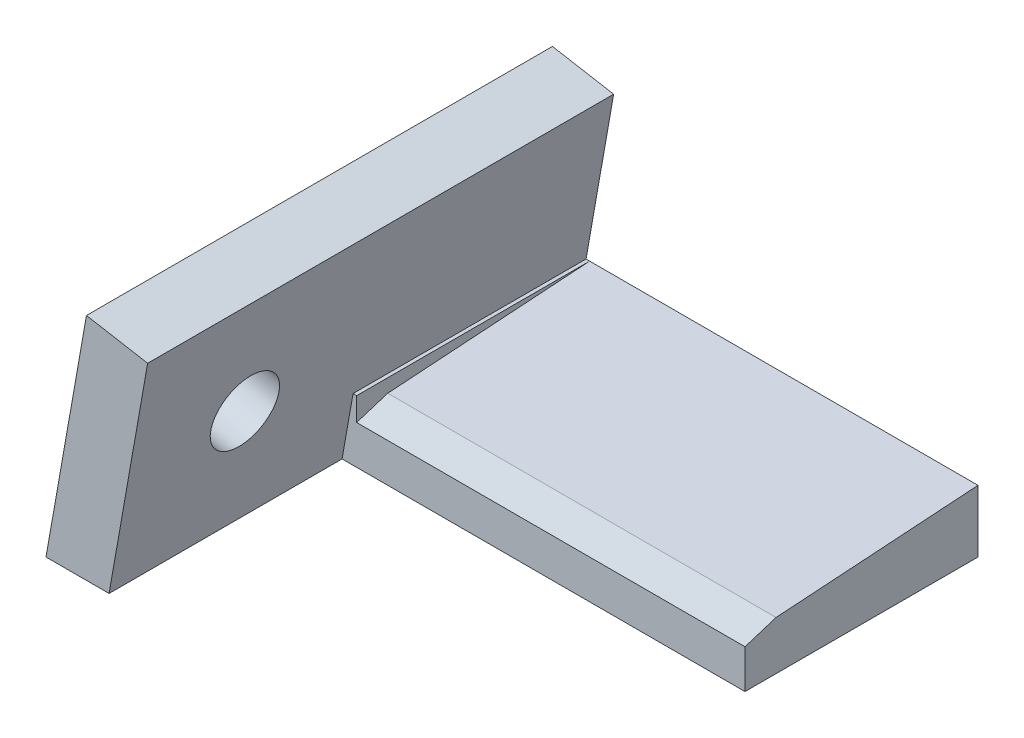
SolidWorks part; units mm, degrees
ref_plane "Спереди" through (0, 0, 0) normal (0, 0, 1) x (1, 0, 0)
ref_plane "Сверху" through (0, 0, 0) normal (0, 1, 0) x (1, 0, 0)
ref_plane "Справа" through (0, 0, 0) normal (1, 0, 0) x (0, 0, -1)
sketch "Эскиз1" plane through (0, 0, 0) normal (0, 0, 1) x (1, 0, 0)
  line L0 (0, 68.933) -> (0, -104.0312) construction
  line L1 (0, -104.0312) -> (0, 0) construction
  line L2 (0, 0) -> (103.0484, 0) construction
  line L3 (103.0484, 0) -> (-126.0729, 0) construction
  line L4 (0, -4) -> (30, -4)
  line L5 (30, -4) -> (30, 0)
  line L6 (30, 0) -> (4.767, 0)
  line L7 (4.767, 0) -> (6.544, 10.0775)
  line L8 (6.544, 10.0775) -> (2.6047, 10.7721)
  line L9 (2.6047, 10.7721) -> (0, -4)
  dimension "D1" = 80
  dimension "D2" = 4
  dimension "D3" = 4
  dimension "D4" = 15
  dimension "D5" = 30
extrude "Бобышка-Вытянуть1" add sketch "Эскиз1" along normal blind 15 contours L4 L5 L6 L7 L8 L9
sketch "Эскиз2" plane through (0, 0, 15) normal (0, 0, 1) x (1, 0, 0)
  line L0 (2.6047, 10.7721) -> (6.544, 10.0775)
  line L1 (6.544, 10.0775) -> (4.0617, -4)
  line L2 (0, -4) -> (30, -4) construction
  line L3 (4.0617, -4) -> (0, -4)
  line L4 (0, -4) -> (2.6047, 10.7721)
extrude "Бобышка-Вытянуть2" add sketch "Эскиз2" along normal blind 15
sketch "Эскиз3" plane through (30, 0, 0) normal (1, 0, 0) x (0, 0, -1)
  line L0 (0, 0) -> (-15, -1)
  line L1 (-15, -4) -> (-15, 0) construction
  line L2 (-15, -1) -> (-15, 0)
  line L3 (-15, 0) -> (0, 0)
  dimension "D1" = 1
extrude "Вырез-Вытянуть4" cut sketch "Эскиз3" against normal blind 25
sketch "Эскиз4" plane through (4.6233, -0.8152, 0) normal (0.9848, -0.1736, 0) x (0, 0, -1)
  line L0 (-30, 11.0608) -> (-15, -3.2339) construction
  line L1 (-15, -3.2339) -> (-30, -3.2339) construction
  line L2 (-30, -3.2339) -> (-15, 11.0608) construction
  line L3 (-30, 11.0608) -> (0, 11.0608) construction
  circle A0 centre (-22.5, 3.9134) radius 2.2
extrude "Вырез-Вытянуть5" cut sketch "Эскиз4" against normal blind 5
sketch "Эскиз5" plane through (30, 0, 0) normal (1, 0, 0) x (0, 0, -1)
  line L0 (-15, -1) -> (-13, -0.8667)
  line L1 (-15, -1) -> (0, 0) construction
  line L2 (-13, -0.8667) -> (-15, -1.5)
  line L3 (-15, -4) -> (-15, -1) construction
  line L4 (-15, -1.5) -> (-15, -1)
  dimension "D1" = 0.5
  dimension "D2" = 2
extrude "Вырез-Вытянуть6" cut sketch "Эскиз5" against normal blind 25
